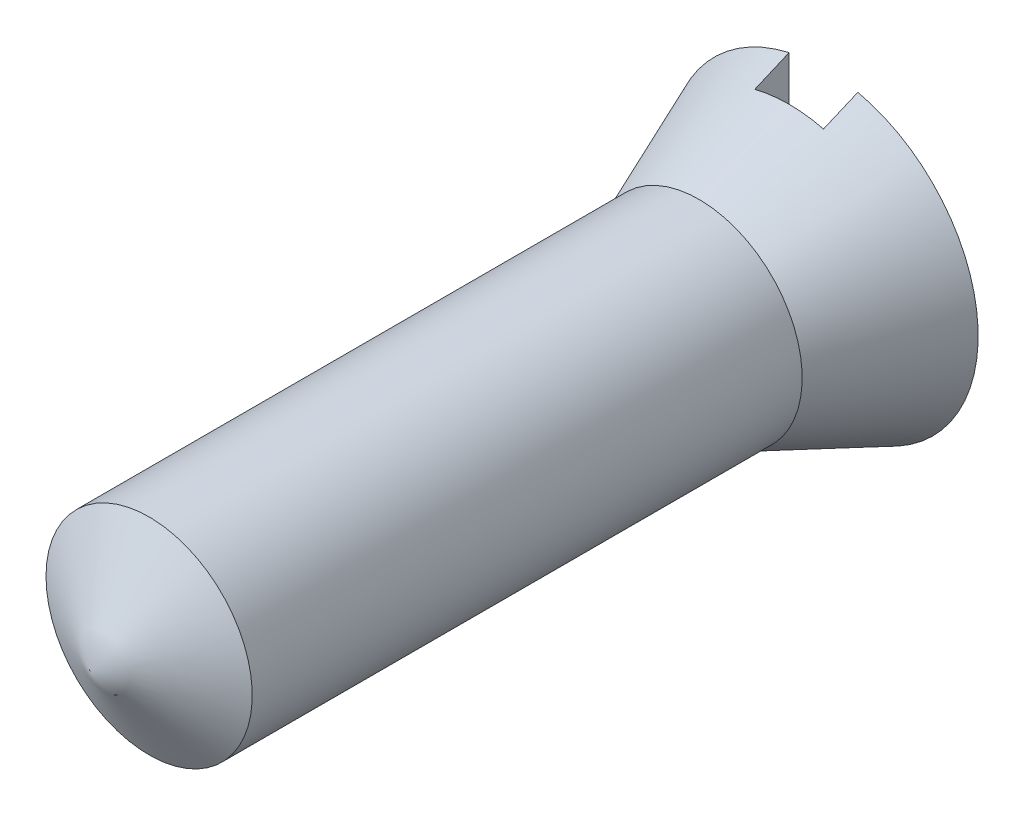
SolidWorks part; units mm, degrees
ref_plane "Front Plane" through (0, 0, 0) normal (0, 0, 1) x (1, 0, 0)
ref_plane "Top Plane" through (0, 0, 0) normal (0, 1, 0) x (1, 0, 0)
ref_plane "Right Plane" through (0, 0, 0) normal (1, 0, 0) x (0, 0, -1)
sketch "Sketch1" plane through (0, 0, 0) normal (0, 1, 0) x (1, 0, 0)
  line L0 (0, 0) -> (0, 21.3521)
  line L1 (0, 21.3521) -> (4.5, 21.3521)
  line L2 (4.5, 21.3521) -> (3, 17.7321)
  line L3 (3, 17.7321) -> (3, 1.7321)
  line L4 (3, 1.7321) -> (0, 0)
  line L5 (0, 0) -> (0, -5.5994) construction
  line L6 (13.1251, 21.3521) -> (4.5, 21.3521) construction
  line L7 (4.5, 21.3521) -> (6.204, 25.4644) construction
  point P9 (-24.3233, 11.9099)
  dimension "D1" = 9
  dimension "D2" = 6
  dimension "D3" = 120
  dimension "D4" = 16
  dimension "D6" = 3.62
revolve "Revolve1" add sketch "Sketch1" angle 360 about L5
sketch "Sketch2" plane through (0, 0, -21.3521) normal (0, 0, -1) x (-1, 0, 0)
  line L1 (-1, -5.2264) -> (1, -5.2264)
  line L2 (-1, -5.2264) -> (-1, 5.2264)
  line L3 (-1, 5.2264) -> (1, 5.2264)
  line L4 (1, -5.2264) -> (1, 5.2264)
  line L5 (-1, -5.2264) -> (1, 5.2264) construction
  line L6 (-1, 5.2264) -> (1, -5.2264) construction
  point P0 (0, 0)
  dimension "D1" = 2
extrude "Cut-Extrude1" cut sketch "Sketch2" against normal blind 1
